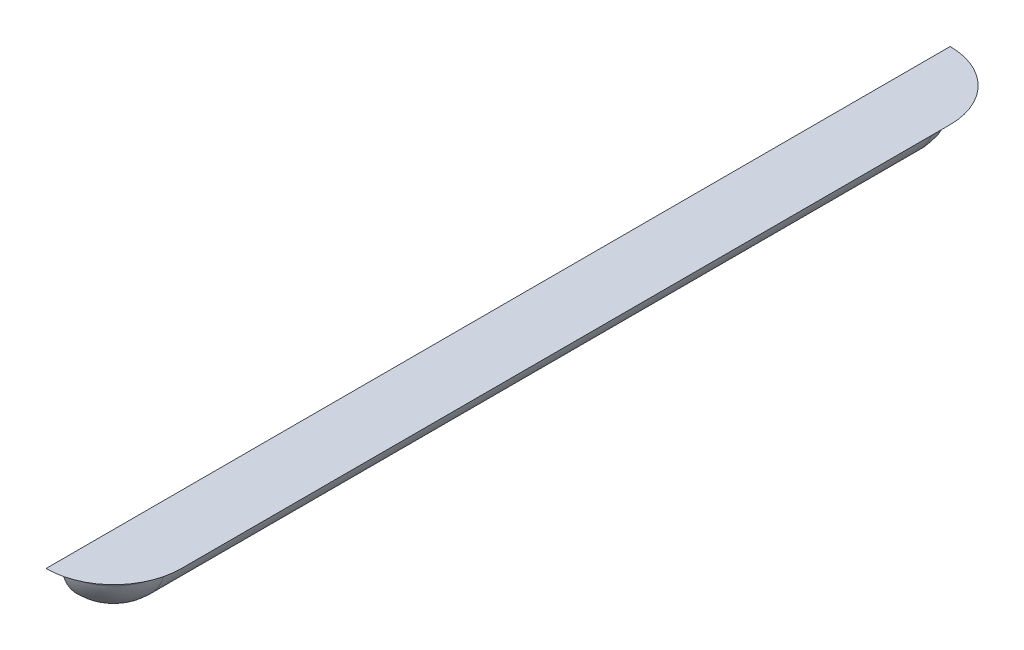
SolidWorks part; units mm, degrees
ref_plane "Plane1" through (0, 0, 0) normal (0, 0, 1) x (1, 0, 0)
ref_plane "Plane2" through (0, 0, 0) normal (0, 1, 0) x (1, 0, 0)
ref_plane "Plane3" through (0, 0, 0) normal (1, 0, 0) x (0, 0, -1)
sketch "Sketch1" plane through (0, 0, 0) normal (0, 0, 1) x (1, 0, 0)
  line L0 (-15, 0) -> (15, 0)
  line L1 (-15, 0) -> (-15, 3.4642)
  line L2 (15, 3.4642) -> (-15, 3.4642)
  line L3 (15, 3.4642) -> (15, 0)
  line L4 (0, 0) -> (0, 3.4642) construction
  line L5 (50, 0) -> (-50, 0) construction
  dimension "D1" = 30
extrude "Base-Extrude" add sketch "Sketch1" along normal mid plane 120
sketch "Layout Sketch" plane through (0, 0, 0) normal (0, -1, 0) x (1, 0, 0)
  line L0 (-6.5173, 0) -> (7.2244, 0) construction
  line L1 (11.2638, 0) -> (-11.2638, 0) construction
  line L2 (0, 9.1132) -> (0, -7.6236) construction
  line L3 (0, -50) -> (0, 50) construction
  line L9 (-3, -50) -> (-3, 50)
  line L11 (3, 44) -> (3, -44)
  arc A0 (3, 44) -> (-3, 50) centre (-3, 44) ccw
  arc A1 (3, -44) -> (-3, -50) centre (-3, -44) cw
sketch "Louver Body" plane through (0, 0, 0) normal (0, 0, 1) x (1, 0, 0)
  line L0 (-3, 0) -> (-3, -6)
  line L1 (-15, 0) -> (15, 0) construction
  line L2 (-3, 0) -> (3, 0)
  line L4 (3, 0) -> (3, 3.4642) construction
  line L5 (15, 3.4642) -> (-15, 3.4642) construction
  line L6 (-3, -6) -> (-3.0249, -6) construction
  line L8 (0, 3.4642) -> (0, 0) construction
  arc A0 (-3, -6) -> (3, 0) centre (-3, 0) ccw
extrude "Boss-Extrude1" add sketch "Louver Body" along normal mid plane 88
sketch "Sketch12" plane through (0, 0, 44) normal (0, 0, 1) x (1, 0, 0)
  line L0 (-3, 0) -> (-3, -6) construction
  line L1 (-3, 0) -> (-3, -6) construction
  line L2 (-15, 0) -> (15, 0) construction
  line L5 (3, 0) -> (-3, 0)
  line L6 (-3, 0) -> (-3, -6)
  line L7 (3, 0) -> (-3, 0)
  line L8 (-3, 0) -> (-3, -6)
  arc A0 (-3, -6) -> (3, 0) centre (-3, 0) ccw construction
  arc A2 (-3, -6) -> (3, 0) centre (-3, 0) ccw
  arc A3 (-3, -6) -> (3, 0) centre (-3, 0) ccw
  dimension "D1" = 0
revolve "Boss-Revolve2" add sketch "Sketch12" angle 90 about L1
sketch "Sketch13" plane through (0, 0, -44) normal (0, 0, -1) x (-1, 0, 0)
  line L0 (3, -6) -> (3, 0) construction
  line L1 (15, 0) -> (-15, 0) construction
  line L2 (3, 0) -> (-3, 0)
  line L3 (3, -6) -> (3, 0)
  line L4 (3, 0) -> (-3, 0)
  line L5 (3, -6) -> (3, 0)
  arc A1 (-3, 0) -> (3, -6) centre (3, 0) ccw
  arc A2 (-3, 0) -> (3, -6) centre (3, 0) ccw
  dimension "D1" = 0
revolve "Boss-Revolve3" add sketch "Sketch13" angle 90 about L0
fillet "Fillet1" radius 2 3 edges at (3, 0, 0) (1.2426, 0, 48.2426) (1.2426, 0, -48.2426)
sketch "Sketch8" plane through (-15, 0, 0) normal (-1, 0, 0) x (0, 0, 1)
  line L4 (-60, 0) -> (60, 0)
  line L5 (60, 0) -> (60, 3.4642)
  line L6 (60, 3.4642) -> (-60, 3.4642)
  line L7 (-60, 3.4642) -> (-60, 0)
  line L8 (-60, 0) -> (60, 0)
  line L9 (60, 0) -> (60, 3.4642)
  line L10 (60, 3.4642) -> (-60, 3.4642)
  line L11 (-60, 3.4642) -> (-60, 0)
  dimension "D1" = 0
extrude "Cut-Extrude4" cut sketch "Sketch8" against normal through all
sketch "Orientation Sketch" plane through (0, 0, 0) normal (0, 1, 0) x (1, 0, 0)
  line L0 (4.746, -44) -> (4.746, 44) construction
  line L1 (-3, -51.746) -> (-3, 51.746) construction
  line L2 (4.746, -44) -> (4.746, 44)
  line L3 (-3, -51.746) -> (-3, 51.746)
  arc A0 (-3, -51.746) -> (4.746, -44) centre (-3, -44) ccw construction
  arc A1 (4.746, 44) -> (-3, 51.746) centre (-3, 44) ccw construction
  arc A2 (-3, -51.746) -> (4.746, -44) centre (-3, -44) ccw
  arc A3 (4.746, 44) -> (-3, 51.746) centre (-3, 44) ccw
  point P5 (0.873, 0)
other "FormTool1"
equation "\"Width@Boss-Extrude1\"=\"Overall width@Layout Sketch\"-2*\"Depth@Layout Sketch\""
